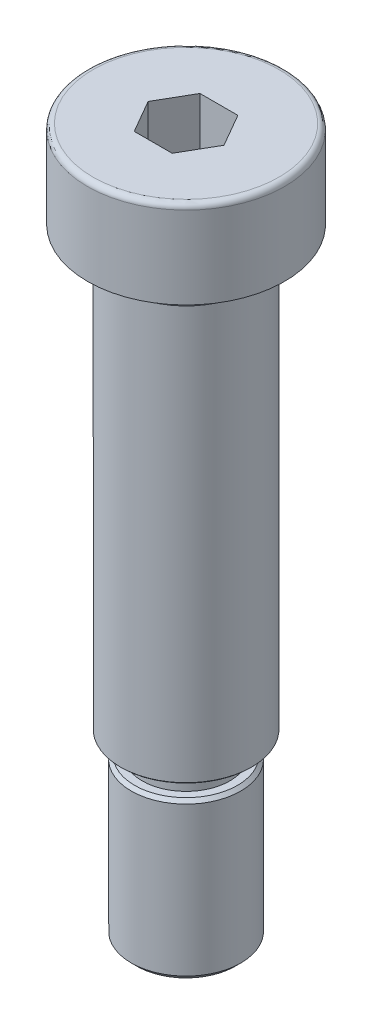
SolidWorks part; units mm, degrees
ref_plane "Plan1" through (0, 0, 0) normal (0, 0, 1) x (1, 0, 0)
ref_plane "Plan2" through (0, 0, 0) normal (0, 1, 0) x (1, 0, 0)
ref_plane "Plan3" through (0, 0, 0) normal (1, 0, 0) x (0, 0, -1)
sketch "Esquisse1" plane through (0, 0, 0) normal (0, 0, 1) x (1, 0, 0)
  line L0 (0, 50) -> (0, -40) construction
  line L1 (0, 64.4) -> (-8.5, 64.4)
  line L3 (-9, 63.9) -> (-9, 56.4)
  line L4 (-9, 56.4) -> (-5, 56.4)
  line L5 (-5, 56.4) -> (-5, 54.4)
  line L6 (-5, 54.4) -> (-6, 54.4)
  line L7 (-6, 54.4) -> (-6, 16.4)
  line L8 (-6, 16.4) -> (-4, 16.4)
  line L9 (-4, 16.4) -> (-4, 14.4)
  line L10 (-4, 14.4) -> (-5, 14.4)
  line L11 (-5, 14.4) -> (-5, 0)
  line L12 (-5, 0) -> (0, 0)
  line L13 (0, 64.4) -> (0, 0)
  arc A0 (-9, 63.9) -> (-8.5, 64.4) centre (-8.5, 63.9) cw
  dimension "D1" = 0.5
  dimension "D2" = 18
  dimension "D3" = 16.4
  dimension "D4" = 8
  dimension "D5" = 1
  dimension "D6" = 2
  dimension "D7" = 12
  dimension "D8" = 40
  dimension "D9" = 4
  dimension "D10" = 2
  dimension "D11" = 10
revolve "Base-Révolution" add sketch "Esquisse1" angle 360 about L0
sketch "Esquisse2" plane through (0, 64.4, 0) normal (0, 1, 0) x (-1, 0, 0)
  line L1 (3.4641, 0) -> (1.7321, 3)
  line L2 (1.7321, 3) -> (-1.7321, 3)
  line L3 (-1.7321, 3) -> (-3.4641, 0)
  line L4 (-3.4641, 0) -> (-1.7321, -3)
  line L5 (-1.7321, -3) -> (1.7321, -3)
  line L6 (1.7321, -3) -> (3.4641, 0)
  circle A0 centre (0, 0) radius 3 construction
  dimension "D1" = 6
extrude "Enlèv. mat.-Extru.1" cut sketch "Esquisse2" against normal blind 5
chamfer "Chanfrein1" distance 0.2 angle 45
fillet "Congé1" radius 0.1
chamfer "Chanfrein2" distance 0.1 angle 45
fillet "Congé2" radius 0.2
chamfer "Chanfrein3" distance 0.5 angle 45
chamfer "Chanfrein4" distance 0.3 angle 45
